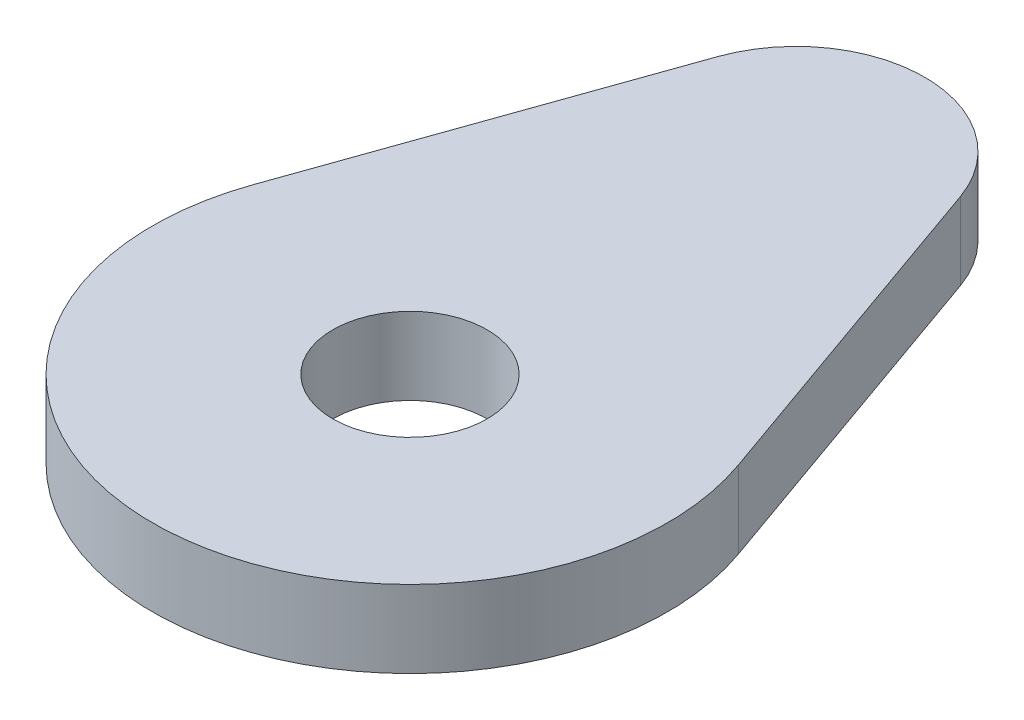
SolidWorks part; units mm, degrees
ref_plane "Front" through (0, 0, 0) normal (0, 0, 1) x (1, 0, 0)
ref_plane "Top" through (0, 0, 0) normal (0, 1, 0) x (1, 0, 0)
ref_plane "Right" through (0, 0, 0) normal (1, 0, 0) x (0, 0, -1)
sketch "Sketch1" plane through (0, 0, 0) normal (0, 1, 0) x (1, 0, 0)
  line L1 (4.714, 16.6667) -> (9.4281, 3.3333)
  line L2 (-4.714, 16.6667) -> (-9.4281, 3.3333)
  circle A0 centre (0, 0) radius 3
  arc A1 (-9.4281, 3.3333) -> (9.4281, 3.3333) centre (0, 0) ccw
  arc A2 (4.714, 16.6667) -> (-4.714, 16.6667) centre (0, 15) ccw
extrude "Extrude2" add sketch "Sketch1" along normal blind 3
